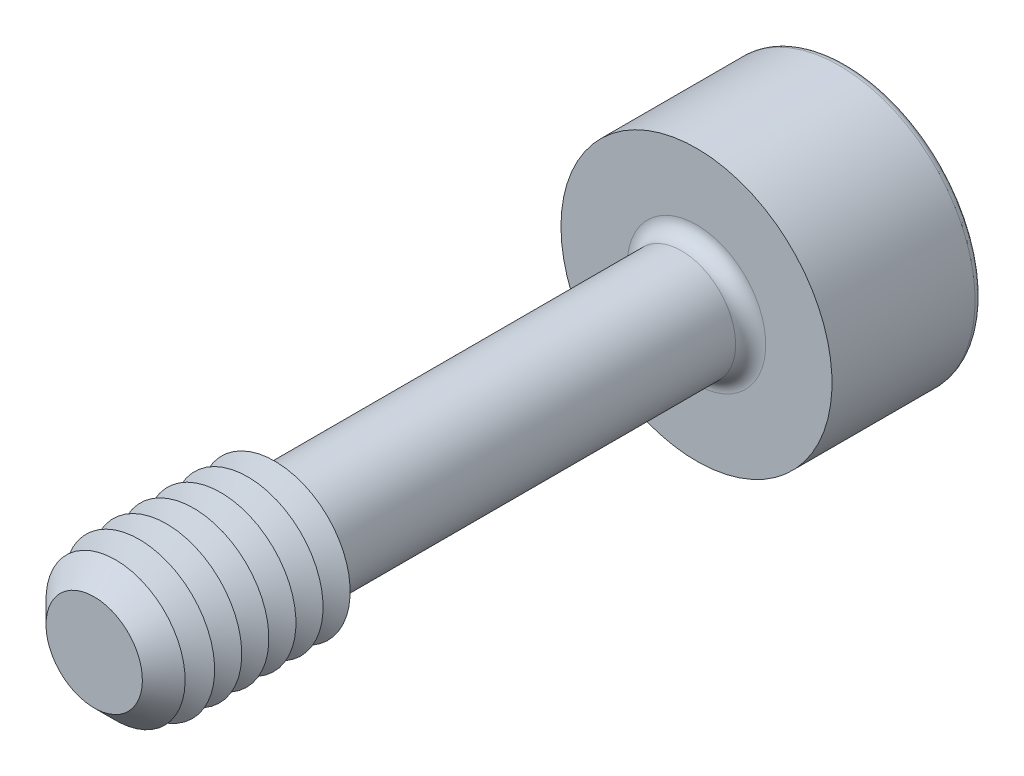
SolidWorks part; units mm, degrees
ref_plane "Front Plane" through (0, 0, 0) normal (0, 0, 1) x (1, 0, 0)
ref_plane "Top Plane" through (0, 0, 0) normal (0, 1, 0) x (1, 0, 0)
ref_plane "Right Plane" through (0, 0, 0) normal (1, 0, 0) x (0, 0, -1)
sketch "Sketch1" plane through (0, 0, 0) normal (0, 0, 1) x (1, 0, 0)
  circle A0 centre (0, 0) radius 0.9
  dimension "D1" = 1.8
extrude "Extrude1" add sketch "Sketch1" along normal mid plane 10
sketch "Sketch2" plane through (0, 0, 0) normal (1, 0, 0) x (0, 0, -1)
  line L0 (-5, 0) -> (-5, 1.25)
  line L1 (-5, 0.9) -> (-5, -0.9) construction
  line L2 (-5, 1.25) -> (-2, 1.25)
  line L3 (-2, 1.25) -> (-1.7979, 0.9)
  line L4 (5, 0.9) -> (-5, 0.9) construction
  line L5 (-1.7979, 0.9) -> (-1.7979, 0)
  line L6 (-1.7979, 0) -> (-5, 0)
  dimension "D1" = 1.25
  dimension "D2" = 120
  dimension "D3" = 3
revolve "Revolve1" add sketch "Sketch2" angle 360 about L6
chamfer "Chamfer1" distance 0.45 angle 45 1 edges at (0, 1.25, 5)
sketch "Sketch3" plane through (0, 0, -5) normal (0, 0, -1) x (-1, 0, 0)
  circle A0 centre (0, 0) radius 2.25
  dimension "D1" = 4.5
extrude "Extrude2" add sketch "Sketch3" along normal blind 2.5
sketch "Sketch4" plane through (-13.7, 0, -7.5) normal (0, 0, 1) x (1, 0, 0)
  line L2 (13.1226, -1) -> (14.2774, -1)
  line L3 (14.2774, -1) -> (14.8547, 0)
  line L4 (14.8547, 0) -> (14.2774, 1)
  line L6 (14.2774, 1) -> (13.1226, 1)
  line L7 (13.1226, 1) -> (12.5453, 0)
  line L8 (12.5453, 0) -> (13.1226, -1)
  circle A0 centre (13.7, 0) radius 1 construction
  dimension "D1" = 2
extrude "Extrude3" cut sketch "Sketch4" along normal blind 2
fillet "Fillet1" radius 0.25 1 edges at (-0.9, 0, -5)
fillet "Fillet2" radius 0.125 1 edges at (-2.25, 0, -7.5)
sketch "Sketch5" plane through (0, 0, 0) normal (1, 0, 0) x (0, 0, -1)
  line L0 (5.5, 0) -> (5.5, -1)
  line L1 (5.5, -1) -> (4.9226, 0)
  line L2 (4.9226, 0) -> (5.5, 0)
  dimension "D1" = 30
revolve "Cut-Revolve1" cut sketch "Sketch5" angle 360 about L2
sketch "Sketch6" plane through (0, 0, 0) normal (1, 0, 0) x (0, 0, -1)
  line L0 (1.332, 0) -> (-13.289, 0) construction
sketch "Sketch7" plane through (0, 0, 0) normal (1, 0, 0) x (0, 0, -1)
  line L0 (-2, 1.25) -> (-2.225, 0.8603)
  line L1 (-2.225, 0.8603) -> (-2.45, 1.25)
  line L2 (-2, 1.25) -> (-4.55, 1.25) construction
  line L3 (-2.45, 1.25) -> (-2, 1.25)
  dimension "D1" = 0.45
revolve "Cut-Revolve2" cut sketch "Sketch7" angle 360 about L0
pattern_linear "LPattern1" count 6 spacing 0.45 along (0, 0, 1) of "Cut-Revolve2"
